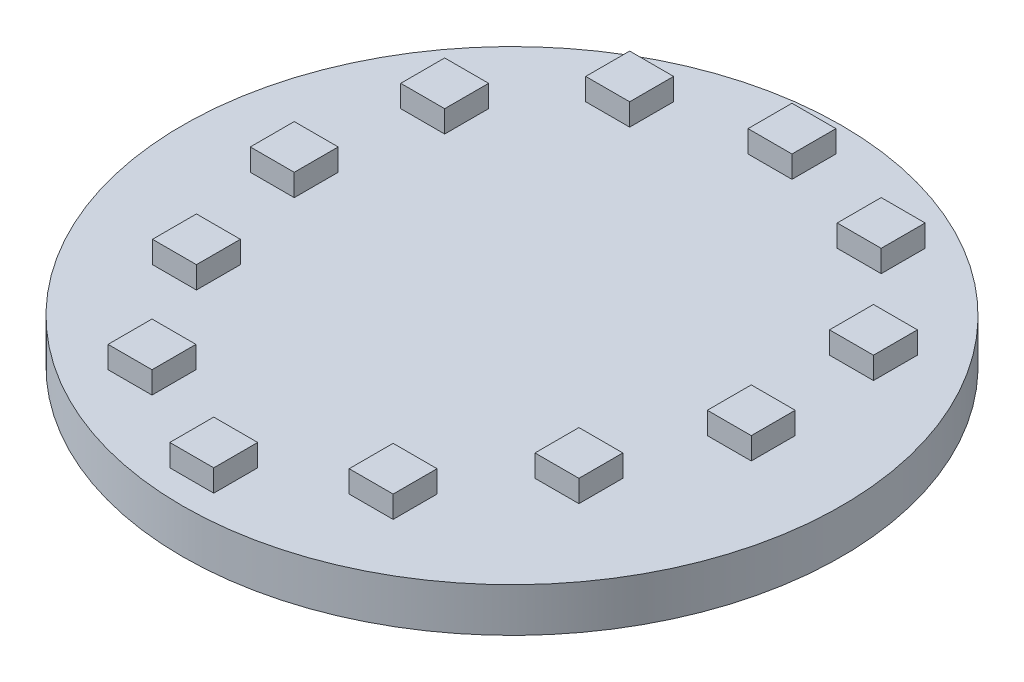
SolidWorks part; units mm, degrees
ref_plane "Front Plane" through (0, 0, 0) normal (0, 0, 1) x (1, 0, 0)
ref_plane "Top Plane" through (0, 0, 0) normal (0, 1, 0) x (1, 0, 0)
ref_plane "Right Plane" through (0, 0, 0) normal (1, 0, 0) x (0, 0, -1)
sketch "Sketch1" plane through (0, 0, 0) normal (0, 1, 0) x (1, 0, 0)
  circle A0 centre (0, 0) radius 75
  dimension "D1" = 150
extrude "Extrude1" add sketch "Sketch1" along normal blind 10
sketch "Sketch2" plane through (0, 10, 0) normal (0, 1, 0) x (1, 0, 0)
  spline S0 degree 3 poles (-51.5644, 46.6194) (2.9095, 73.0589) (62.5512, 38.2909) (45.3453, -27.7483) (-12.2606, -85.4788) (-58.7693, -14.821) (-51.5644, 46.6194) (2.9095, 73.0589) (62.5512, 38.2909) knots -0.487306 -0.296516 -0.130022 0 0.157248 0.342767 0.512694 0.703484 0.869978 1 1.157248 1.342767 1.512694 only from (0, 63.7158) to (0, 63.7158)
sketch "Sketch4" plane through (0, 10, 0) normal (0, 1, 0) x (1, 0, 0)
  line L1 (-5, 58.7158) -> (5, 58.7158)
  line L2 (-5, 58.7158) -> (-5, 68.7158)
  line L3 (-5, 68.7158) -> (5, 68.7158)
  line L4 (5, 58.7158) -> (5, 68.7158)
  line L5 (-5, 58.7158) -> (5, 68.7158) construction
  line L6 (-5, 68.7158) -> (5, 58.7158) construction
  point P0 (0, 63.7158)
  dimension "D1" = 10
  dimension "D2" = 10
extrude "Extrude2" add sketch "Sketch4" along normal blind 5
pattern_curve "CrvPattern1" of "Extrude2" parameters "D1"=12, "D3"=10, "D2"=1, "D4"=10
